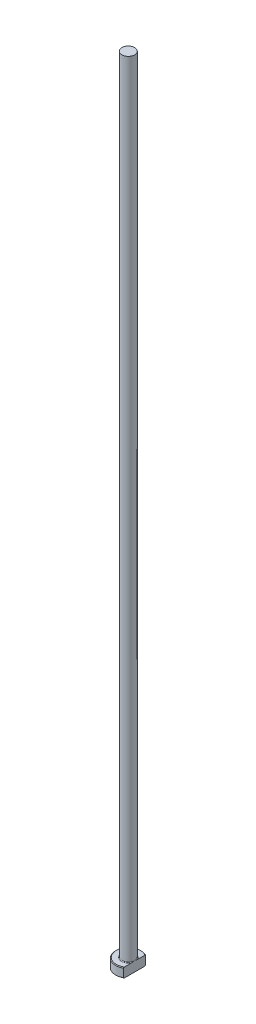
SolidWorks part; units mm, degrees
ref_plane "Front Plane" through (0, 0, 0) normal (0, 0, 1) x (1, 0, 0)
ref_plane "Top Plane" through (0, 0, 0) normal (0, 1, 0) x (1, 0, 0)
ref_plane "Right Plane" through (0, 0, 0) normal (1, 0, 0) x (0, 0, -1)
sketch "Sketch1" plane through (0, 0, 0) normal (0, 0, 1) x (1, 0, 0)
  line L0 (0, 259.9588) -> (0, -15.1925) construction
  line L1 (0, 0) -> (-4, 0)
  line L2 (-4, 0) -> (-4, 3)
  line L3 (-4, 3) -> (-2, 3)
  line L4 (-2, 3) -> (-2, 250)
  line L5 (-2, 250) -> (0, 250)
  line L6 (0, 250) -> (0, 0)
  dimension "L" = 250
  dimension "H" = 8
  dimension "T" = 3
  dimension "D" = 4
revolve "Revolve1" add sketch "Sketch1" angle 360 about L0
chamfer "Chamfer1" distance 0.2 angle 45 2 edges at (0, 3, 4) (0, 0, 4)
fillet "Fillet1" radius 0.2 1 edges at (0, 3, 2)
sketch "Sketch2" plane through (0, 0, 0) normal (0, 1, 0) x (1, 0, 0)
  line L0 (2, 3.4641) -> (2, -3.4641)
  circle A0 centre (0, 0) radius 4 construction
  arc A1 (2, -3.4641) -> (2, 3.4641) centre (0, 0) ccw
  circle A2 centre (0, 0) radius 2 construction
extrude "KEY" cut sketch "Sketch2" along normal through all
